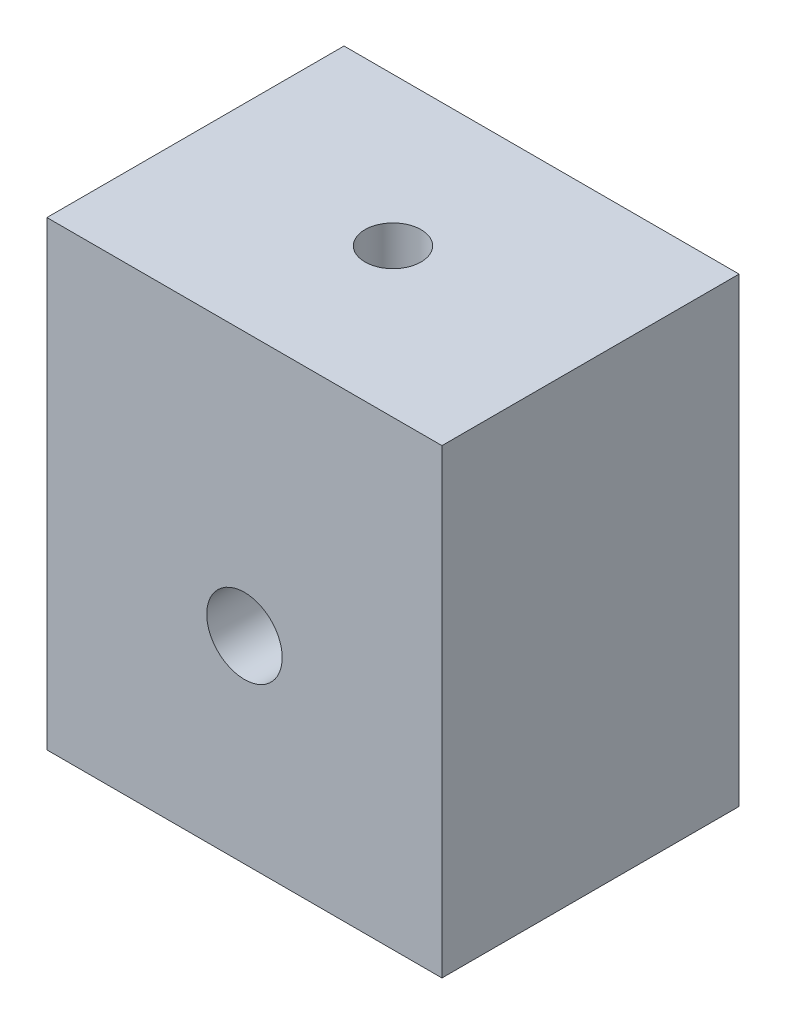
SolidWorks part; units mm, degrees
ref_plane "Front Plane" through (0, 0, 0) normal (0, 0, 1) x (1, 0, 0)
ref_plane "Top Plane" through (0, 0, 0) normal (0, 1, 0) x (1, 0, 0)
ref_plane "Right Plane" through (0, 0, 0) normal (1, 0, 0) x (0, 0, -1)
sketch "Sketch1" plane through (0, 0, 0) normal (0, 0, 1) x (1, 0, 0)
  line L1 (-12.95, -12.95) -> (12.95, -12.95)
  line L2 (-12.95, -12.95) -> (-12.95, 12.95)
  line L3 (-12.95, 12.95) -> (12.95, 12.95)
  line L4 (12.95, -12.95) -> (12.95, 12.95)
  line L5 (-12.95, -12.95) -> (12.95, 12.95) construction
  line L6 (-12.95, 12.95) -> (12.95, -12.95) construction
  line L7 (-17.95, -17.95) -> (17.95, -17.95)
  line L8 (-17.95, -17.95) -> (-17.95, 17.95)
  line L9 (-17.95, 17.95) -> (17.95, 17.95)
  line L10 (17.95, -17.95) -> (17.95, 17.95)
  line L11 (-17.95, -17.95) -> (17.95, 17.95) construction
  line L12 (-17.95, 17.95) -> (17.95, -17.95) construction
  point P0 (0, 0)
  point P6 (0, 0)
  dimension "D1" = 25.9
  dimension "D2" = 25.9
  dimension "D3" = 35.9
  dimension "D4" = 35.9
extrude "Boss-Extrude1" add sketch "Sketch1" against normal blind 20
sketch "Sketch2" plane through (0, 0, 0) normal (0, 0, 1) x (1, 0, 0)
  line L1 (-17.95, -17.95) -> (17.95, -17.95)
  line L2 (-17.95, -17.95) -> (-17.95, 17.95)
  line L3 (-17.95, 17.95) -> (17.95, 17.95)
  line L4 (17.95, -17.95) -> (17.95, 17.95)
  line L5 (-17.95, -17.95) -> (17.95, 17.95) construction
  line L6 (-17.95, 17.95) -> (17.95, -17.95) construction
  point P0 (0, 0)
extrude "Boss-Extrude2" add sketch "Sketch2" along normal blind 7
sketch "Sketch3" plane through (0, 0, 7) normal (0, 0, 1) x (1, 0, 0)
  circle A0 centre (0, 0) radius 3.43
  dimension "D1" = 6.86
extrude "Cut-Extrude1" cut sketch "Sketch3" against normal blind 10
sketch "Sketch10" plane through (0, 17.95, 0) normal (0, 1, 0) x (1, 0, 0)
  line L0 (0, 20) -> (0, -15.2648) construction
  line L1 (17.95, 20) -> (-17.95, 20) construction
  line L2 (-17.95, 6.5) -> (17.95, 6.5) construction
  line L3 (-17.95, 20) -> (-17.95, -7) construction
  circle A0 centre (0, 6.5) radius 2.54
  dimension "D1" = 5.08
extrude "Cut-Extrude3" cut sketch "Sketch10" against normal blind 10
sketch "Sketch11" plane through (0, 17.95, 0) normal (0, 1, 0) x (1, 0, 0)
  line L1 (-17.95, 20) -> (17.95, 20)
  line L2 (-17.95, 20) -> (-17.95, -7)
  line L3 (-17.95, -7) -> (17.95, -7)
  line L4 (17.95, 20) -> (17.95, -7)
extrude "Boss-Extrude3" add sketch "Sketch11" along normal blind 6
sketch "Sketch12" plane through (0, 23.95, 0) normal (0, 1, 0) x (1, 0, 0)
  line L0 (-2.54, 6.5) -> (2.54, 6.5) construction
  line L1 (0, 9.04) -> (0, 3.96) construction
  circle A0 centre (0, 6.5) radius 2.54 construction
  circle A1 centre (0, 6.5) radius 2.55
  dimension "D1" = 5.1
extrude "Cut-Extrude4" cut sketch "Sketch12" against normal blind 8
